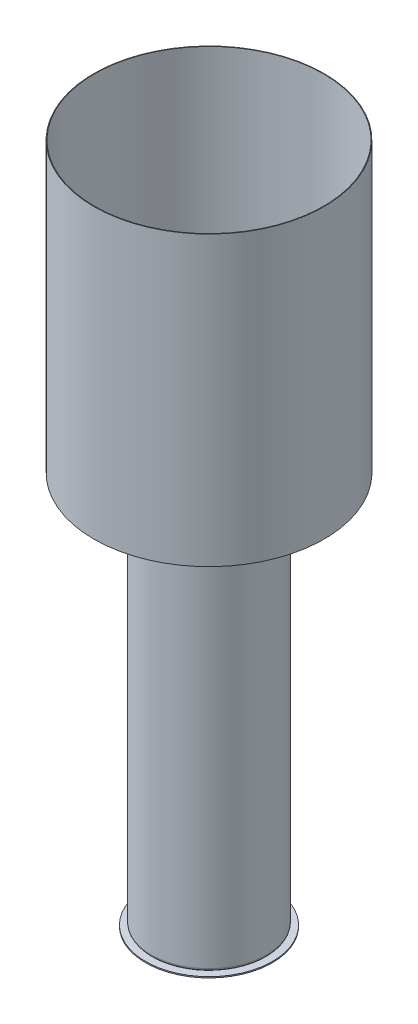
SolidWorks part; units mm, degrees
ref_plane "Alzado" through (0, 0, 0) normal (0, 0, 1) x (1, 0, 0)
ref_plane "Planta" through (0, 0, 0) normal (0, 1, 0) x (1, 0, 0)
ref_plane "Vista lateral" through (0, 0, 0) normal (1, 0, 0) x (0, 0, -1)
sketch "Croquis1" plane through (0, 0, 0) normal (0, 1, 0) x (1, 0, 0)
  circle A0 centre (0, 0) radius 100
  dimension "D1" = 200
extrude "Saliente-Extruir1" add sketch "Croquis1" along normal blind 700
shell "Vaciado1" thickness 15
fillet "Redondeo1" radius 10 1 edges at (0, 700, 100)
sketch "Croquis3" plane through (0, 700, 0) normal (0, 1, 0) x (1, 0, 0)
  circle A0 centre (0, 0) radius 5
  dimension "D1" = 10
extrude "Cortar-Extruir1" cut sketch "Croquis3" against normal blind 600
fillet "Redondeo2" radius 5 1 edges at (0, 0, 100)
sketch "Croquis4" plane through (0, 700, 0) normal (0, 1, 0) x (1, 0, 0)
  circle A0 centre (0, 0) radius 10
  dimension "D1" = 20
extrude "Saliente-Extruir2" add sketch "Croquis4" along normal blind 20 separate body
sketch "Croquis5" plane through (0, 720, 0) normal (0, 1, 0) x (1, 0, 0)
  circle A0 centre (0, 0) radius 200
  circle A1 centre (0, 0) radius 199
  dimension "D1" = 400
  dimension "D2" = 398
extrude "Saliente-Extruir3" add sketch "Croquis5" along normal blind 460 and the other way blind 40 separate body
sketch "Croquis6" plane through (0, 0, 0) normal (0, -1, 0) x (1, 0, 0)
  circle A0 centre (0, 0) radius 110
  dimension "D1" = 220
extrude "Saliente-Extruir4" add sketch "Croquis6" along normal blind 2 separate body
